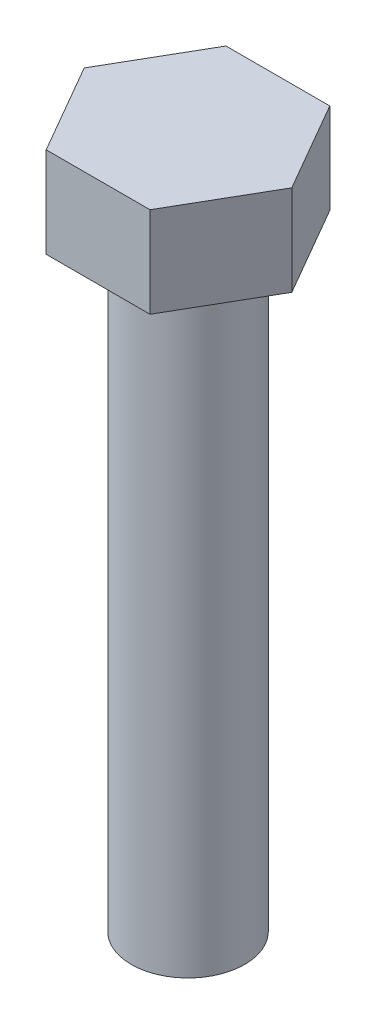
SolidWorks part; units mm, degrees
ref_plane "Front Plane" through (0, 0, 0) normal (0, 0, 1) x (1, 0, 0)
ref_plane "Top Plane" through (0, 0, 0) normal (0, 1, 0) x (1, 0, 0)
ref_plane "Right Plane" through (0, 0, 0) normal (1, 0, 0) x (0, 0, -1)
sketch "sk nut washer" plane through (0, 0, 0) normal (0, 1, 0) x (1, 0, 0)
  line B0 (0, 0) -> (-42.5864, -73.7618) construction
  line B1 (39.4114, -68.2625) -> (78.8227, 0)
  line B2 (78.8227, 0) -> (39.4114, 68.2625)
  line B3 (39.4114, 68.2625) -> (-39.4114, 68.2625)
  line B4 (-39.4114, 68.2625) -> (-78.8227, 0)
  line B5 (-78.8227, 0) -> (-39.4114, -68.2625)
  line B6 (-39.4114, -68.2625) -> (39.4114, -68.2625)
  line B7 (0, 0) -> (25.4, 0) construction
  circle B8 centre (0, 0) radius 44.45
  circle B9 centre (0, 0) radius 68.2625 construction
  circle B10 centre (0, 0) radius 85.1727
sketch_block_instance "Block1-1"
sketch_block "Block1" parameters "D1"=88.9, "D2"=136.525, "D3"=6.35, "D4"=40.7227, "D5"=25.4, "D6"=32.7673
sketch "Sketch2" plane through (0, 0, 0) normal (0, 1, 0) x (1, 0, 0)
  circle A0 centre (0, 0) radius 19.05
  dimension "D1" = 38.1
sketch "Sketch3" plane through (0, 0, 0) normal (0, 1, 0) x (1, 0, 0)
  line L1 (17.4143, -30.1625) -> (34.8287, 0)
  line L2 (34.8287, 0) -> (17.4143, 30.1625)
  line L3 (17.4143, 30.1625) -> (-17.4143, 30.1625)
  line L4 (-17.4143, 30.1625) -> (-34.8287, 0)
  line L5 (-34.8287, 0) -> (-17.4143, -30.1625)
  line L6 (-17.4143, -30.1625) -> (17.4143, -30.1625)
  circle A0 centre (0, 0) radius 30.1625 construction
  dimension "D1" = 60.325
extrude "Boss-Extrude1" add sketch "Sketch3" along normal blind 30.3784
extrude "Boss-Extrude2" add sketch "Sketch2" against normal blind 203.2
